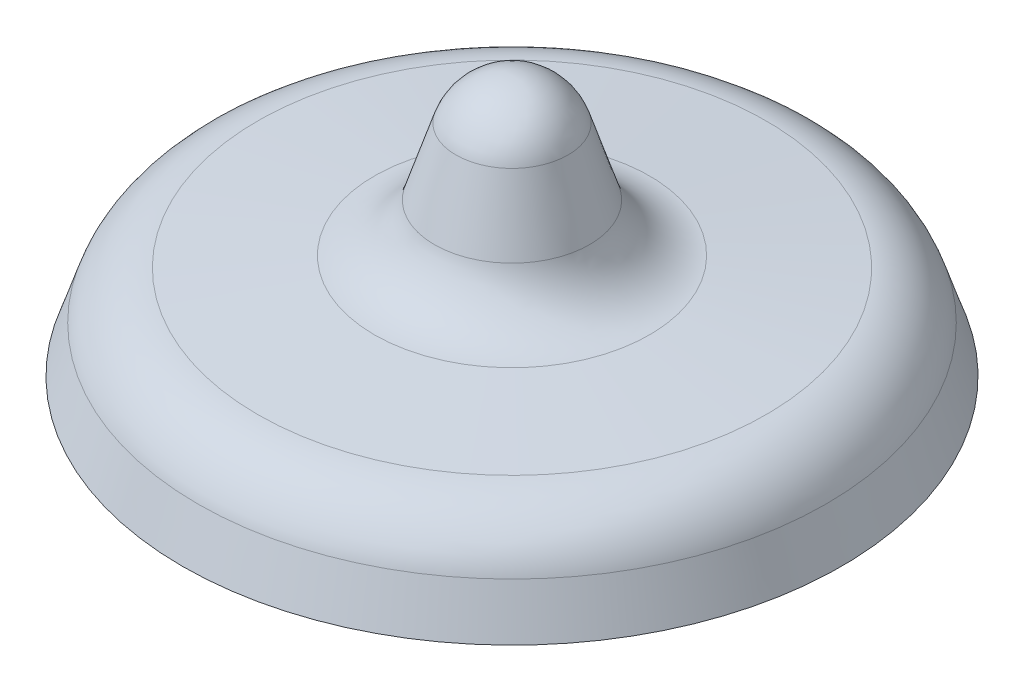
SolidWorks part; units mm, degrees
ref_plane "Front" through (0, 0, 0) normal (0, 0, 1) x (1, 0, 0)
ref_plane "Top" through (0, 0, 0) normal (0, 1, 0) x (1, 0, 0)
ref_plane "Right" through (0, 0, 0) normal (1, 0, 0) x (0, 0, -1)
sketch "Sketch1" plane through (0, 0, 0) normal (0, 0, 1) x (1, 0, 0)
  line L0 (0, 0) -> (0, -35.6282) construction
  line L1 (0, 0) -> (111.5817, 0)
  line L2 (111.5817, 0) -> (106.3751, 15.6866)
  line L3 (86.1083, 31.7727) -> (46.5997, 35.3969)
  line L4 (26.2709, 51.6724) -> (18.9707, 74.3032)
  line L5 (0, 0) -> (0, 88.1169)
  arc A0 (18.9707, 74.3032) -> (0, 88.1169) centre (0, 68.1836) ccw
  arc A1 (106.3751, 15.6866) -> (86.1083, 31.7727) centre (83.9499, 8.2433) ccw
  arc A2 (46.5997, 35.3969) -> (26.2709, 51.6724) centre (48.7581, 58.9263) cw
revolve "Revolve1" add sketch "Sketch1" angle 360 about L0
